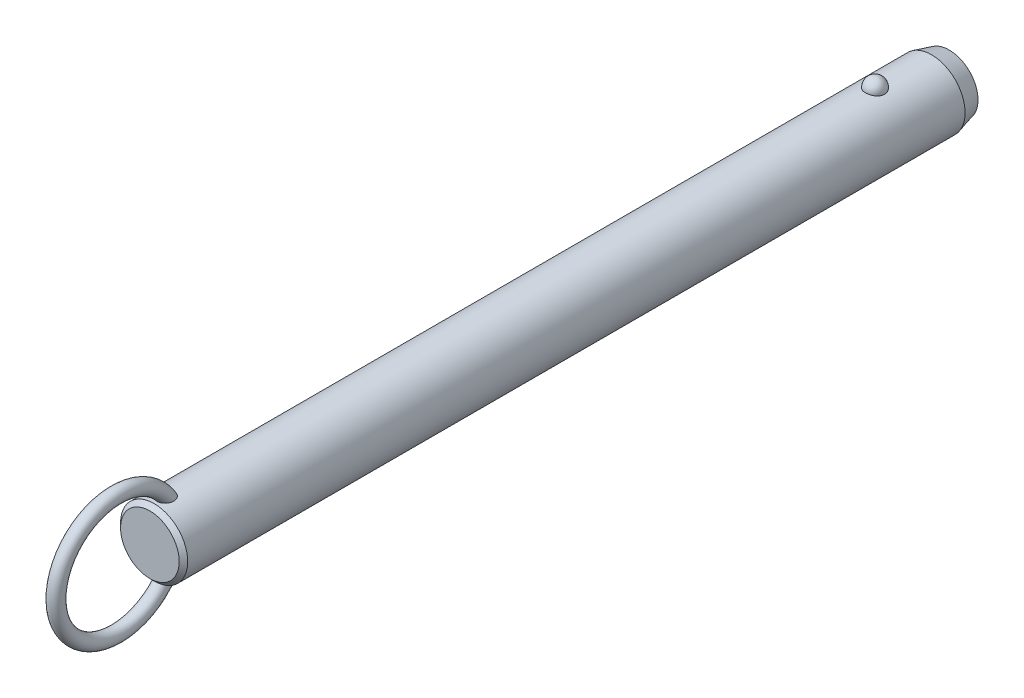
SolidWorks part; units mm, degrees
ref_plane "Front Plane" through (0, 0, 0) normal (0, 0, 1) x (1, 0, 0)
ref_plane "Top Plane" through (0, 0, 0) normal (0, 1, 0) x (1, 0, 0)
ref_plane "Right Plane" through (0, 0, 0) normal (1, 0, 0) x (0, 0, -1)
sketch "Sketch2" plane through (0, 0, 0) normal (0, 0, 1) x (1, 0, 0)
  circle A0 centre (0, 0) radius 9.5
  point P3 (0, 9.5)
  dimension "D1" = 19
extrude "Boss-Extrude1" add sketch "Sketch2" along normal blind 193
sketch "Sketch3" plane through (0, 0, 0) normal (0, 0, -1) x (-1, 0, 0)
  circle A0 centre (0, 0) radius 9.5
  dimension "D1" = 19
extrude "Boss-Extrude2" add sketch "Sketch3" along normal blind 23.7
chamfer "Chamfer1" distance 5 angle 15 1 edges at (-9.5, 0, -23.7)
sketch "Sketch12" plane through (0, 0, 0) normal (1, 0, 0) x (0, 0, -1)
  line L0 (-193, 9.5) -> (-193, -9.5) construction
  point P0 (-193, 0)
sketch "Sketch13" plane through (0, 0, 0) normal (1, 0, 0) x (0, 0, -1)
  circle A0 centre (-212.05, 0) radius 19.05
  point P2 (-193, 0)
  dimension "D1" = 38.1
sketch "Sketch14" plane through (0, 0, 0) normal (0, 1, 0) x (1, 0, 0)
  circle A0 centre (0, -195) radius 2
  point P2 (0, -193)
  dimension "D1" = 4
sweep "Sweep1" add profiles "Sketch14" path "Sketch13"
sketch "Sketch15" plane through (0, 0, 193) normal (0, 0, 1) x (1, 0, 0)
  circle A0 centre (0, 0) radius 9.5
  dimension "D1" = 19
extrude "Boss-Extrude3" add sketch "Sketch15" along normal blind 9.52
chamfer "Chamfer2" distance 1.2 angle 45 1 edges at (9.5, 0, 202.52)
sketch "Sketch18" plane through (0, 0, 0) normal (1, 0, 0) x (0, 0, -1)
  line L0 (18.7, 9.5) -> (-195.5378, 9.5) construction
  line L1 (2.7, 12.2) -> (2.7, 6.8)
  line L2 (-195.5378, -9.5) -> (18.7, -9.5) construction
  arc A0 (2.7, 12.2) -> (2.7, 6.8) centre (2.7, 9.5) ccw
  point P4 (0, 9.5)
  dimension "D1" = 21.7
revolve "Revolve1" add sketch "Sketch18" angle 360 about L1
